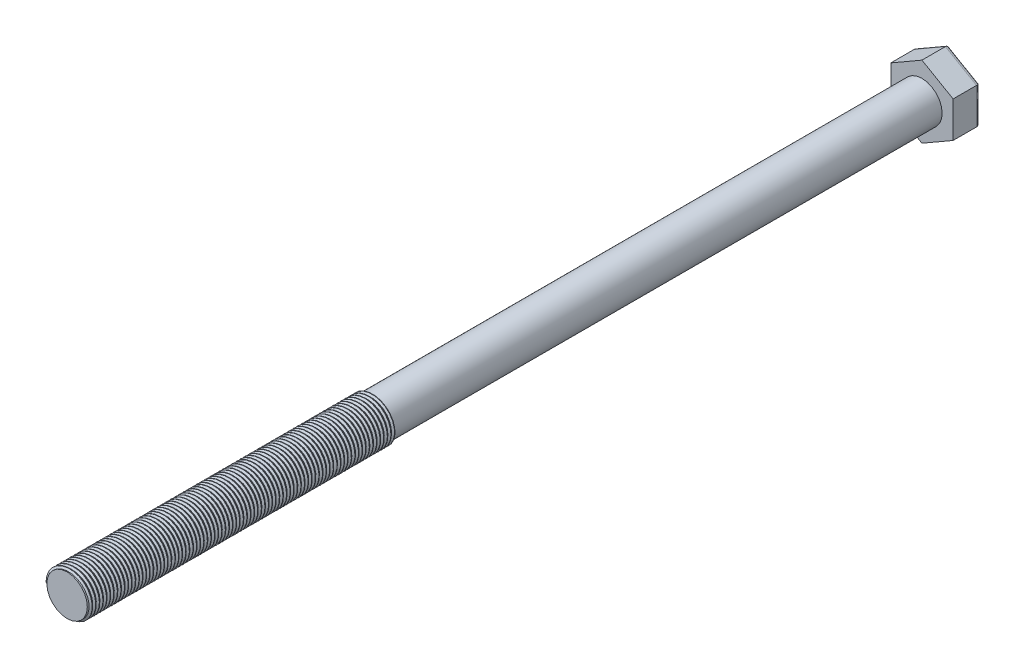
SolidWorks part; units mm, degrees
ref_plane "Front Plane" through (0, 0, 0) normal (0, 0, 1) x (1, 0, 0)
ref_plane "Top Plane" through (0, 0, 0) normal (0, 1, 0) x (1, 0, 0)
ref_plane "Right Plane" through (0, 0, 0) normal (1, 0, 0) x (0, 0, -1)
sketch "Sketch1" plane through (0, 0, 0) normal (0, 0, 1) x (1, 0, 0)
  line L1 (0, -12.7) -> (10.9985, -6.35)
  line L2 (10.9985, -6.35) -> (10.9985, 6.35)
  line L3 (10.9985, 6.35) -> (0, 12.7)
  line L4 (0, 12.7) -> (-10.9985, 6.35)
  line L5 (-10.9985, 6.35) -> (-10.9985, -6.35)
  line L6 (-10.9985, -6.35) -> (0, -12.7)
  circle A0 centre (0, 0) radius 12.7 construction
extrude "Boss-Extrude1" add sketch "Sketch1" along normal blind 9.525
ref_plane "Plane1" through (0, 0, 9.525) normal (0, 0, 1) x (1, 0, 0)
sketch "Sketch2" plane through (0, 0, 9.525) normal (0, 0, 1) x (1, 0, 0)
  circle A0 centre (0, 0) radius 7.1438
  point P3 (-25.3312, -13.1179)
  dimension "D1" = 14.2875
extrude "Boss-Extrude2" add sketch "Sketch2" along normal blind 301.625
thread "Thread1" pitch 1.27 start angle 0, offset 0, length 107.95, pitch 1.27, diameter 14.2875
ref_plane "Plane2" through (-7.1438, 0, 311.15) normal (0, -1, 0) x (-1, 0, 0)
sketch "Thread Profile1" plane through (-7.1438, 0, 311.15) normal (0, -1, 0) x (-1, 0, 0)
  line L0 (0, 0) -> (0, 1.27) construction
  line L1 (0, 0) -> (0.6874, 0.3969)
  line L2 (0.6874, 0.3969) -> (0.6874, 0.5556)
  line L3 (0.6874, 0.5556) -> (0, 0.9525)
  line L4 (0.6874, 0.4762) -> (0, 0.4762) construction
  line L11 (0, 0) -> (0, 0.9525)
  point P2 (0, 0)
  dimension "Pitch" = 1.27
  dimension "Profile_Angle" = 60
  dimension "Profile_Land" = 0.1588
  dimension "Profile_Height" = 0.6874
fillet "Fillet1" radius 1.27 6 edges at (5.4993, -9.525, 0) (10.9985, 0, 0) (5.4993, 9.525, 0) (-5.4993, 9.525, 0) (-10.9985, 0, 0) (-5.4993, -9.525, 0)
